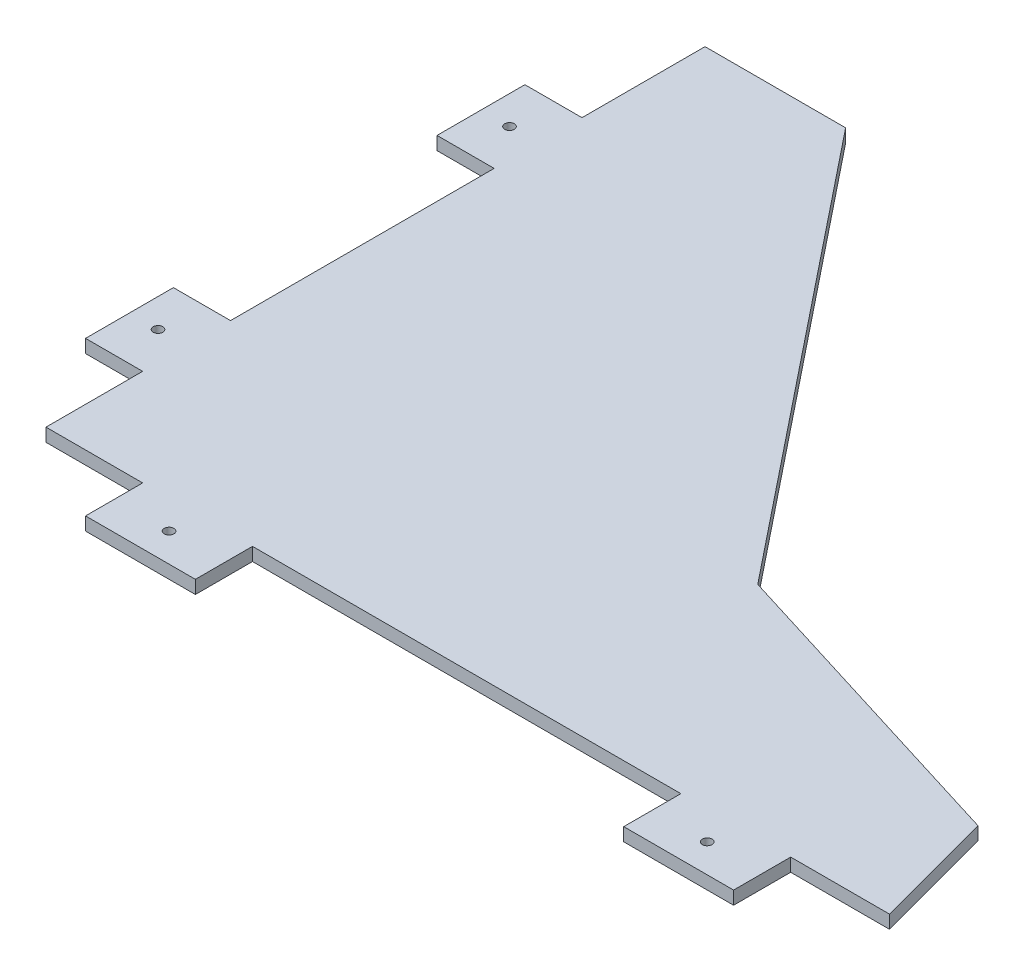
SolidWorks part; units mm, degrees
ref_plane "Ebene vorne" through (0, 0, 0) normal (0, 0, 1) x (1, 0, 0)
ref_plane "Ebene oben" through (0, 0, 0) normal (0, 1, 0) x (1, 0, 0)
ref_plane "Ebene rechts" through (0, 0, 0) normal (1, 0, 0) x (0, 0, -1)
sketch "Skizze1" plane through (0, 0, 0) normal (0, 1, 0) x (1, 0, 0)
  line L0 (0, 86.8409) -> (0, -76.1078) construction
  line L1 (-105.0548, 0) -> (105.7053, 0) construction
  line L2 (-192, 54) -> (-192, -66)
  line L3 (-192, 150) -> (192, 150) construction
  line L4 (-192, 150) -> (-192, 94)
  line L5 (-192, -150) -> (-148, -150)
  line L6 (192, 150) -> (192, -150) construction
  line L7 (-192, -106) -> (-218, -106)
  line L8 (-192, 54) -> (-218, 54)
  line L9 (-192, -66) -> (-218, -66)
  line L10 (-218, -106) -> (-218, -66)
  line L11 (-98, -150) -> (97, -150)
  line L12 (-192, 94) -> (-218, 94)
  line L13 (-192, -106) -> (-192, -150)
  line L14 (-218, 54) -> (-218, 94)
  line L15 (147, -150) -> (192, -150)
  line L16 (-148, -150) -> (-148, -176)
  line L17 (-148, -176) -> (-98, -176)
  line L18 (-98, -150) -> (-98, -176)
  line L19 (-128, 150) -> (32, -50)
  line L20 (97, -150) -> (97, -176)
  line L21 (97, -176) -> (147, -176)
  line L22 (147, -150) -> (147, -176)
  line L23 (32, -50) -> (177.2628, -95)
  line L24 (177.2628, -95) -> (192, -150)
  line L25 (-192, 150) -> (-128, 150)
  line L26 (-205, 94) -> (-205, 54) construction
  line L27 (-218, 74) -> (-192, 74) construction
  line L28 (-205, -66) -> (-205, -106) construction
  line L29 (-218, -86) -> (-192, -86) construction
  line L30 (-148, -163) -> (147, -163) construction
  line L31 (-123, -176) -> (-123, -150) construction
  line L32 (122, -176) -> (122, -150) construction
  circle A0 centre (-205, 74) radius 2.2
  circle A1 centre (-205, -86) radius 2.2
  circle A2 centre (-123, -163) radius 2.2
  circle A3 centre (122, -163) radius 2.2
  dimension "D19" = 4.4
  dimension "D1" = 384
  dimension "D2" = 300
  dimension "D3" = 44
  dimension "D4" = 26
  dimension "D5" = 40
  dimension "D6" = 40
  dimension "D7" = 26
  dimension "D8" = 120
  dimension "D9" = 26
  dimension "D10" = 50
  dimension "D11" = 50
  dimension "D12" = 44
  dimension "D13" = 195
  dimension "D14" = 64
  dimension "D15" = 160
  dimension "D16" = 55
  dimension "D17" = 15
  dimension "D18" = 100
extrude "Aufsatz-Linear austragen1" add sketch "Skizze1" along normal blind 6
